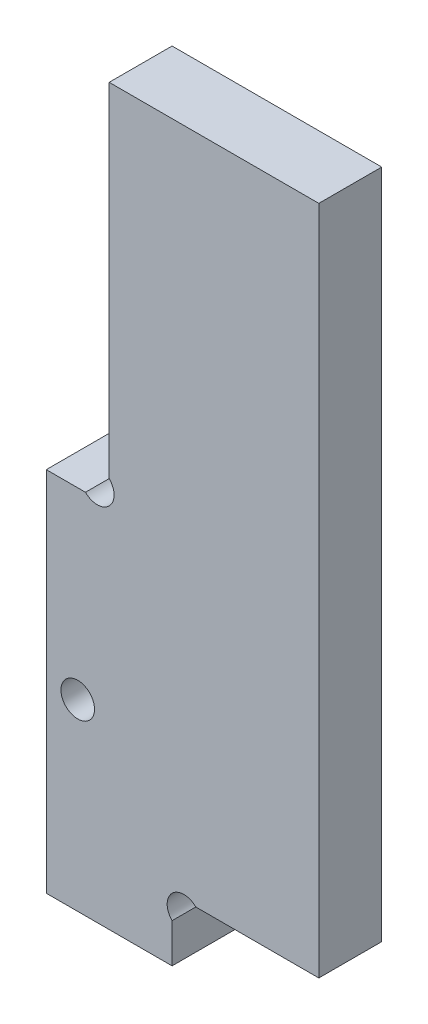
SolidWorks part; units mm, degrees
ref_plane "Plan de face" through (0, 0, 0) normal (0, 0, 1) x (1, 0, 0)
ref_plane "Plan de dessus" through (0, 0, 0) normal (0, 1, 0) x (1, 0, 0)
ref_plane "Plan de droite" through (0, 0, 0) normal (1, 0, 0) x (0, 0, -1)
sketch "Esquisse1" plane through (0, 0, 0) normal (0, 0, 1) x (1, 0, 0)
  line L0 (0, -11.0038) -> (0, 90.4459) construction
  line L1 (-1.8905, 0) -> (50.7248, 0) construction
  line L2 (-9.6619, 70) -> (50.7248, 70) construction
  line L3 (-9.6619, 35) -> (41.2425, 35) construction
  line L4 (26, -11.0038) -> (26, 90.4459) construction
  line L5 (6, 76.425) -> (6, 30.5721) construction
  line L6 (-1.8905, 6) -> (32.1507, 6) construction
  line L7 (12, -11.0038) -> (12, 6.9512) construction
  line L8 (12, 6) -> (23.3733, -5.3733) construction
  line L9 (3, 36.1294) -> (3, 13.1885) construction
  line L10 (6, 35) -> (-6.4461, 47.4461) construction
  line L11 (-1.8905, 17.5) -> (32.1507, 17.5) construction
  line L12 (12, 3.7373) -> (12, 0)
  line L13 (12, 0) -> (0, 0)
  line L14 (0, 0) -> (0, 35)
  line L15 (0, 35) -> (3.7373, 35)
  line L16 (14.2627, 6) -> (26, 6)
  line L17 (26, 6) -> (26, 70)
  line L18 (26, 70) -> (6, 70)
  line L19 (6, 70) -> (6, 37.2627)
  arc A0 (14.2627, 6) -> (12, 3.7373) centre (13.1314, 4.8686) ccw
  arc A1 (3.7373, 35) -> (6, 37.2627) centre (4.8686, 36.1314) ccw
  circle A2 centre (3, 17.5) radius 1.6
  dimension "D1" = 26
  dimension "D2" = 35
  dimension "D3" = 70
  dimension "D4" = 12
  dimension "D5" = 6
  dimension "D6" = 6
  dimension "D7" = 45
  dimension "D8" = 45
  dimension "D9" = 17.5
  dimension "D10" = 3
extrude "Boss.-Extru.1" add sketch "Esquisse1" along normal blind 6
